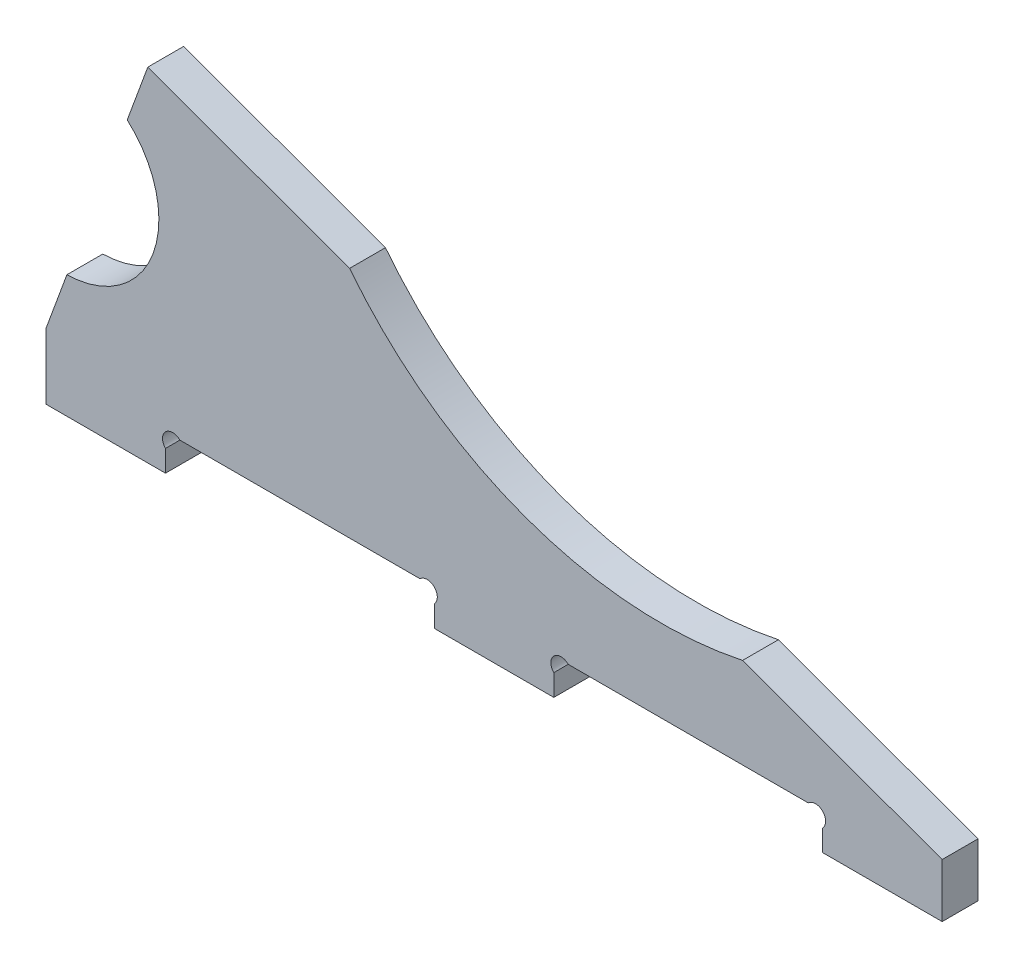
SolidWorks part; units mm, degrees
ref_plane "Plan de face" through (0, 0, 0) normal (0, 0, 1) x (1, 0, 0)
ref_plane "Plan de dessus" through (0, 0, 0) normal (0, 1, 0) x (1, 0, 0)
ref_plane "Plan de droite" through (0, 0, 0) normal (1, 0, 0) x (0, 0, -1)
sketch "Esquisse1" plane through (0, 0, 0) normal (0, 0, 1) x (1, 0, 0)
  line L0 (0, -10.1545) -> (0, 72.9561) construction
  line L1 (0, 0) -> (150, 0) construction
  line L2 (-0.6721, 6) -> (178.773, 6) construction
  line L3 (150, -5.5276) -> (150, 30.8552) construction
  line L4 (158.7596, 9) -> (143.0488, 9) construction
  line L5 (150, 9) -> (17.0424, 57.3926) construction
  line L6 (-7.4437, 11) -> (7.4437, 11) construction
  line L7 (20, -10.1545) -> (20, 11) construction
  line L8 (130, -10.1545) -> (130, 9) construction
  line L9 (65, -10.1545) -> (65, 11.8523) construction
  line L10 (85, -10.1545) -> (85, 9) construction
  line L11 (0, 11) -> (8.4765, 34.289) construction
  line L12 (0, 0) -> (20, 0)
  line L13 (22.4042, 6) -> (62.5958, 6)
  line L14 (65, 0) -> (85, 0)
  line L15 (87.4042, 6) -> (127.5958, 6)
  line L16 (130, 0) -> (150, 0)
  line L17 (0, 0) -> (0, 11)
  line L18 (20, 0) -> (20, 3.5958)
  line L19 (65, 0) -> (65, 3.5958)
  line L20 (85, 0) -> (85, 3.5958)
  line L21 (130, 0) -> (130, 3.5958)
  line L22 (150, 0) -> (150, 9)
  line L23 (0, 11) -> (3.4976, 20.521)
  line L24 (17.0424, 57.3926) -> (50.8135, 45.1009)
  line L25 (92.0091, 55.9516) -> (60.2118, -31.4106) construction
  line L26 (-10.771, 41.3596) -> (48.5476, 19.5688) construction
  line L27 (4.4671, 51.3279) -> (117.919, 10.0347) construction
  line L28 (29.5633, 62.4762) -> (-0.643, -19.7509) construction
  line L29 (57.7088, 64.0455) -> (28.967, -14.9219) construction
  line L30 (-0.093, 21.8522) -> (21.7182, 13.7659) construction
  line L31 (116.592, 21.1595) -> (150, 9)
  line L32 (118.3451, 25.976) -> (111.407, 6.9138) construction
  line L33 (13.5942, 48.0059) -> (17.0424, 57.3926)
  line L34 (13.4837, 48.0461) -> (23.3768, 75.2271) construction
  line L35 (42.5, 1.8538) -> (42.5, 17.0671) construction
  line L36 (75, -6.6526) -> (75, 3.4784) construction
  line L37 (20, 6) -> (29.5591, -3.5591) construction
  line L38 (75, -28.5726) -> (75, 55.9516) construction
  arc A0 (116.592, 21.1595) -> (50.8135, 45.1009) centre (102.9414, 85.9879) cw
  arc A1 (13.5942, 48.0059) -> (3.4976, 20.521) centre (3.1795, 36.2348) cw
  arc A2 (22.4042, 6) -> (20, 3.5958) centre (21.2021, 4.7979) ccw
  arc A3 (62.5958, 6) -> (65, 3.5958) centre (63.7979, 4.7979) cw
  arc A4 (127.5958, 6) -> (130, 3.5958) centre (128.7979, 4.7979) cw
  arc A5 (87.4042, 6) -> (85, 3.5958) centre (86.2021, 4.7979) ccw
  dimension "D1" = 110
  dimension "D2" = 160
  dimension "D3" = 10
  dimension "D4" = 10
  dimension "D5" = 35
  dimension "D6" = 45
extrude "Extrusion1" add sketch "Esquisse1" along normal blind 6
